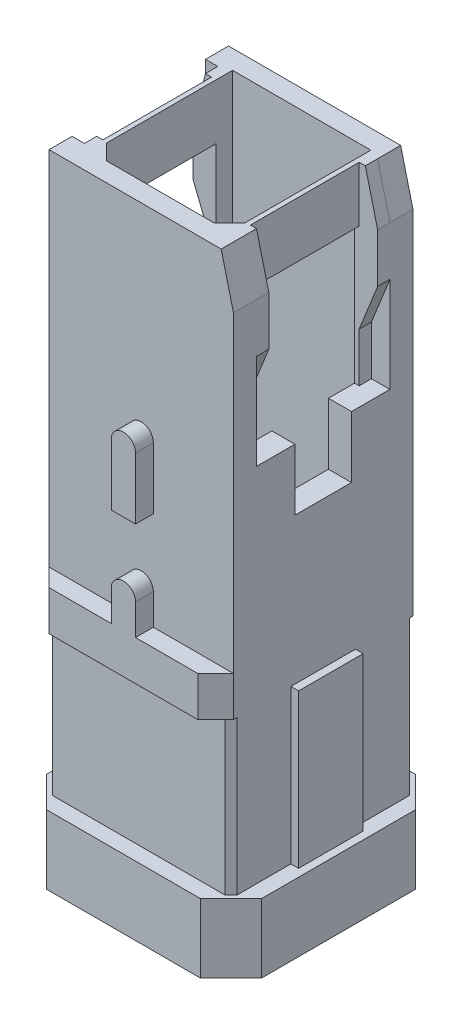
SolidWorks part; units mm, degrees
ref_plane "Top" through (0, 0, 0) normal (0, 0, 1) x (1, 0, 0)
ref_plane "Front" through (0, 0, 0) normal (0, 1, 0) x (1, 0, 0)
ref_plane "Side" through (0, 0, 0) normal (1, 0, 0) x (0, 0, -1)
sketch "Sketch1" plane through (0, 0, 0) normal (0, 1, 0) x (1, 0, 0)
  line L0 (4.445, 4.445) -> (-4.445, -4.445) construction
  line L1 (-4.445, -4.445) -> (4.445, -4.445)
  line L2 (-4.445, -4.445) -> (-4.445, 4.445)
  line L3 (-4.445, 4.445) -> (4.445, 4.445)
  line L4 (4.445, -4.445) -> (4.445, 4.445)
  dimension "D1" = 8.89
extrude "Base-Extrude" add sketch "Sketch1" along normal blind 2.8448
chamfer "Chamfer1" distance 1.27 angle 45
sketch "Sketch2" plane through (0, 2.8448, 0) normal (0, 1, 0) x (-1, 0, 0)
  line L0 (-3.81, 3.81) -> (3.81, -3.81) construction
  line L1 (3.81, -3.81) -> (-3.81, -3.81)
  line L2 (3.81, -3.81) -> (3.81, 3.81)
  line L3 (3.81, 3.81) -> (-3.81, 3.81)
  line L4 (-3.81, -3.81) -> (-3.81, 3.81)
  dimension "D1" = 7.62
extrude "Boss-Extrude1" add sketch "Sketch2" along normal blind 6.35
chamfer "Chamfer2" distance 0.254 angle 45
sketch "Sketch3" plane through (0, 9.1948, 0) normal (0, 1, 0) x (-1, 0, 0)
  line L0 (-3.81, 3.556) -> (-3.81, -3.556) construction
  line L1 (3.81, -3.7084) -> (-3.81, -3.7084)
  line L2 (3.81, -3.7084) -> (3.81, 3.7084)
  line L3 (3.81, 3.7084) -> (-3.81, 3.7084)
  line L4 (-3.81, -3.7084) -> (-3.81, 3.7084)
  line L5 (3.81, -3.556) -> (3.81, 3.556) construction
  line L6 (-3.81, 3.7084) -> (3.81, -3.7084) construction
  dimension "D1" = 7.4168
extrude "Boss-Extrude2" add sketch "Sketch3" along normal offset from surface 25.781
sketch "Sketch4" plane through (0, 0, 0) normal (0, 0, 1) x (1, 0, 0)
  line L0 (3.81, 9.1948) -> (3.81, 2.8448) construction
  line L1 (-4.1275, 2.8448) -> (-3.81, 2.8448)
  line L2 (-4.1275, 2.8448) -> (-4.1275, 9.1948)
  line L3 (-4.1275, 9.1948) -> (-3.81, 9.1948)
  line L4 (-3.81, 2.8448) -> (-3.81, 9.1948)
  line L5 (3.81, 2.8448) -> (4.1275, 2.8448)
  line L6 (3.81, 2.8448) -> (3.81, 9.1948)
  line L7 (3.81, 9.1948) -> (4.1275, 9.1948)
  line L8 (4.1275, 2.8448) -> (4.1275, 9.1948)
  line L9 (-3.81, 2.8448) -> (-3.81, 9.1948) construction
  line L10 (0, 0) -> (0, 14.9659) construction
  line L11 (-4.445, 2.8448) -> (-3.81, 2.8448) construction
  line L12 (-3.81, 9.1948) -> (-3.6576, 9.1948) construction
  dimension "D1" = 8.255
extrude "Boss-Extrude3" add sketch "Sketch4" along normal mid plane 2.667
sketch "Sketch5" plane through (0, 0, 0) normal (0, -1, 0) x (1, 0, 0)
  line L0 (0, 0) -> (2.7164, 0) construction
  line L1 (0, 0) -> (0, -1.6962) construction
  line L24 (3.4925, -3.1115) -> (3.4925, 3.1115)
  line L26 (3.4925, 3.1115) -> (-3.4925, 3.1115)
  line L28 (-3.4925, 3.1115) -> (-3.4925, -3.1115)
  line L30 (-3.4925, -3.1115) -> (3.4925, -3.1115)
  dimension "D1" = 6.223
  dimension "D2" = 6.985
extrude "Cut-Extrude1" cut sketch "Sketch5" against normal blind 2.667
chamfer "Chamfer7" distance 1.27 angle 45
sketch "Sketch6" plane through (0, 25.781, 0) normal (0, 1, 0) x (-1, 0, 0)
  line L0 (-2.8575, 2.921) -> (2.8575, -2.921) construction
  line L1 (-2.2225, 2.921) -> (2.2225, 2.921)
  line L2 (-2.8575, 2.286) -> (-2.8575, -2.921)
  line L3 (-2.8575, -2.921) -> (2.8575, -2.921)
  line L4 (2.8575, 2.286) -> (2.8575, -2.921)
  line L5 (2.8575, 2.286) -> (2.2225, 2.921)
  line L6 (0, 0) -> (0, 2.0877) construction
  line L7 (-2.8575, 2.286) -> (-2.2225, 2.921)
  dimension "D1" = 5.715
  dimension "D2" = 5.842
  dimension "D3" = 45
  dimension "D4" = 0.635
extrude "Cut-Extrude2" cut sketch "Sketch6" against normal through all
sketch "Sketch7" plane through (3.81, 0, 0) normal (1, 0, 0) x (0, 0, -1)
  line L0 (0, 0) -> (0, 12.8189) construction
  line L1 (-2.7559, 17.78) -> (-1.1684, 17.78)
  line L2 (-2.7559, 17.78) -> (-2.7559, 25.781)
  line L3 (-2.7559, 25.781) -> (2.7559, 25.781)
  line L4 (2.7559, 17.78) -> (2.7559, 25.781)
  line L5 (-1.1684, 15.24) -> (1.1684, 15.24)
  line L6 (-1.1684, 15.24) -> (-1.1684, 17.78)
  line L8 (1.1684, 15.24) -> (1.1684, 17.78)
  line L9 (3.7084, 25.781) -> (-3.7084, 25.781) construction
  line L10 (1.1684, 17.78) -> (2.7559, 17.78)
  dimension "D1" = 5.5118
  dimension "D2" = 2.3368
  dimension "D3" = 8.001
  dimension "D4" = 2.54
extrude "Cut-Extrude3" cut sketch "Sketch7" against normal blind 0.762
chamfer "Chamfer4" distance 0.508 distance2 2.032
sketch "Sketch8" plane through (0, 0, 2.7559) normal (0, 0, -1) x (-1, 0, 0)
  line L0 (-3.048, 25.781) -> (-3.302, 25.781) construction
  line L1 (-3.81, 25.781) -> (-3.81, 9.1948) construction
  line L2 (-3.81, 23.749) -> (-3.81, 21.717)
  line L3 (-3.81, 21.717) -> (-3.048, 19.812)
  line L4 (-3.048, 17.78) -> (-3.048, 25.781) construction
  line L5 (-3.048, 25.781) -> (-3.048, 17.78) construction
  line L6 (-3.048, 25.781) -> (-3.048, 19.812)
  line L7 (-3.302, 25.781) -> (-3.81, 23.749) construction
  line L8 (-3.302, 25.781) -> (-3.81, 23.749)
  line L9 (-3.048, 25.781) -> (-3.302, 25.781)
  dimension "D2" = 2.032
  dimension "D3" = 2.032
extrude "Boss-Extrude5" add sketch "Sketch8" along normal blind 0.508
sketch "Sketch9" plane through (0, 0, -2.7559) normal (0, 0, 1) x (1, 0, 0)
  line L5 (3.302, 25.781) -> (3.048, 25.781)
  line L6 (3.81, 23.749) -> (3.302, 25.781)
  line L7 (3.81, 21.717) -> (3.81, 23.749)
  line L8 (3.048, 19.812) -> (3.81, 21.717)
  line L9 (3.048, 25.781) -> (3.048, 19.812)
  line L10 (3.302, 25.781) -> (3.048, 25.781)
  line L11 (3.81, 23.749) -> (3.302, 25.781)
  line L12 (3.81, 21.717) -> (3.81, 23.749)
  line L13 (3.048, 19.812) -> (3.81, 21.717)
  line L14 (3.048, 25.781) -> (3.048, 19.812)
  dimension "D1" = 0
extrude "Boss-Extrude6" add sketch "Sketch9" along normal blind 0.508
sketch "Sketch10" plane through (3.048, 0, 0) normal (1, 0, 0) x (0, 0, -1)
  line L0 (-2.2479, 23.495) -> (2.2479, 23.495)
  line L12 (2.7559, 19.812) -> (2.2479, 19.812)
  line L13 (2.2479, 19.812) -> (2.2479, 25.781)
  line L14 (2.2479, 25.781) -> (-2.2479, 25.781)
  line L15 (-2.2479, 25.781) -> (-2.2479, 19.812)
  line L16 (-2.2479, 19.812) -> (-2.7559, 19.812)
  line L17 (-2.7559, 19.812) -> (-2.7559, 17.78)
  line L18 (-2.7559, 17.78) -> (-1.1684, 17.78)
  line L19 (-1.1684, 17.78) -> (-1.1684, 15.24)
  line L20 (-1.1684, 15.24) -> (1.1684, 15.24)
  line L21 (1.1684, 15.24) -> (1.1684, 17.78)
  line L22 (1.1684, 17.78) -> (2.7559, 17.78)
  line L23 (2.7559, 17.78) -> (2.7559, 19.812)
  line L25 (2.2479, 17.78) -> (2.2479, 23.495)
  line L27 (-2.2479, 23.495) -> (-2.2479, 17.78)
  line L30 (-2.2479, 17.78) -> (-1.1684, 17.78)
  line L31 (-1.1684, 17.78) -> (-1.1684, 15.24)
  line L32 (-1.1684, 15.24) -> (1.1684, 15.24)
  line L33 (1.1684, 15.24) -> (1.1684, 17.78)
  line L34 (1.1684, 17.78) -> (2.2479, 17.78)
  dimension "D1" = 0
extrude "Cut-Extrude5" cut sketch "Sketch10" against normal blind 3.175
mirror "Mirror1" about plane through (0, 0, 0) normal (1, 0, 0)
sketch "Sketch11" plane through (0, 0, 0) normal (1, 0, 0) x (0, 0, -1)
  line L0 (4.445, 2.8448) -> (4.445, 0) construction
  line L1 (3.7084, 10.8458) -> (4.445, 10.8458)
  line L2 (3.7084, 10.8458) -> (3.7084, 9.1948)
  line L3 (3.7084, 9.1948) -> (4.445, 9.1948)
  line L4 (4.445, 10.8458) -> (4.445, 9.1948)
  line L5 (-4.445, 10.8458) -> (-3.7084, 10.8458)
  line L6 (-4.445, 10.8458) -> (-4.445, 9.1948)
  line L7 (-4.445, 9.1948) -> (-3.7084, 9.1948)
  line L8 (-3.7084, 10.8458) -> (-3.7084, 9.1948)
  line L9 (-4.445, 0) -> (-4.445, 2.8448) construction
  line L10 (-3.7084, 23.749) -> (-3.7084, 9.1948) construction
  line L11 (3.7084, 23.749) -> (3.7084, 9.1948) construction
  dimension "D1" = 1.651
extrude "Boss-Extrude7" add sketch "Sketch11" along normal mid plane 7.62
chamfer "Chamfer5" distance 0.7366 angle 45
sketch "Sketch12" plane through (0, 0, 3.7084) normal (0, 0, 1) x (1, 0, 0)
  line L0 (0.501, 12.1158) -> (0.501, 10.8458)
  line L1 (-0.501, 12.1158) -> (-0.501, 10.8458)
  line L2 (-0.501, 10.8458) -> (0.501, 10.8458)
  line L3 (0.501, 17.4474) -> (0.501, 14.9074)
  line L4 (-0.501, 17.4474) -> (-0.501, 14.9074)
  line L5 (-0.501, 14.9074) -> (0.501, 14.9074)
  line L6 (3.0734, 10.8458) -> (-3.0734, 10.8458) construction
  arc A0 (0.501, 12.1158) -> (-0.501, 12.1158) centre (0, 12.1158) ccw
  arc A1 (0.501, 17.4474) -> (-0.501, 17.4474) centre (0, 17.4474) ccw
  dimension "D1" = 0.501
  dimension "D2" = 1.27
  dimension "D3" = 2.54
  dimension "D4" = 5.3316
extrude "Boss-Extrude8" add sketch "Sketch12" along normal up to surface
sketch "Sketch13" plane through (0, 0, -3.7084) normal (0, 0, -1) x (-1, 0, 0)
  line L0 (0.501, 14.9074) -> (-0.501, 14.9074) construction
  line L1 (-0.501, 14.9074) -> (-0.501, 17.4474) construction
  line L2 (0.501, 17.4474) -> (0.501, 14.9074) construction
  line L3 (0.501, 14.9074) -> (-0.501, 14.9074)
  line L4 (-0.501, 14.9074) -> (-0.501, 17.4474)
  line L5 (0.501, 17.4474) -> (0.501, 14.9074)
  line L6 (-0.501, 10.8458) -> (-0.501, 12.1158) construction
  line L7 (0.501, 12.1158) -> (0.501, 10.8458) construction
  line L8 (-0.501, 10.8458) -> (-0.501, 12.1158)
  line L9 (0.501, 12.1158) -> (0.501, 10.8458)
  line L10 (-3.0734, 10.8458) -> (3.0734, 10.8458) construction
  line L11 (-0.501, 10.8458) -> (0.501, 10.8458)
  arc A0 (0.501, 17.4474) -> (-0.501, 17.4474) centre (0, 17.4474) ccw construction
  arc A1 (0.501, 17.4474) -> (-0.501, 17.4474) centre (0, 17.4474) ccw
  arc A2 (0.501, 12.1158) -> (-0.501, 12.1158) centre (0, 12.1158) ccw construction
  arc A3 (0.501, 12.1158) -> (-0.501, 12.1158) centre (0, 12.1158) ccw
extrude "Boss-Extrude9" add sketch "Sketch13" along normal up to surface
